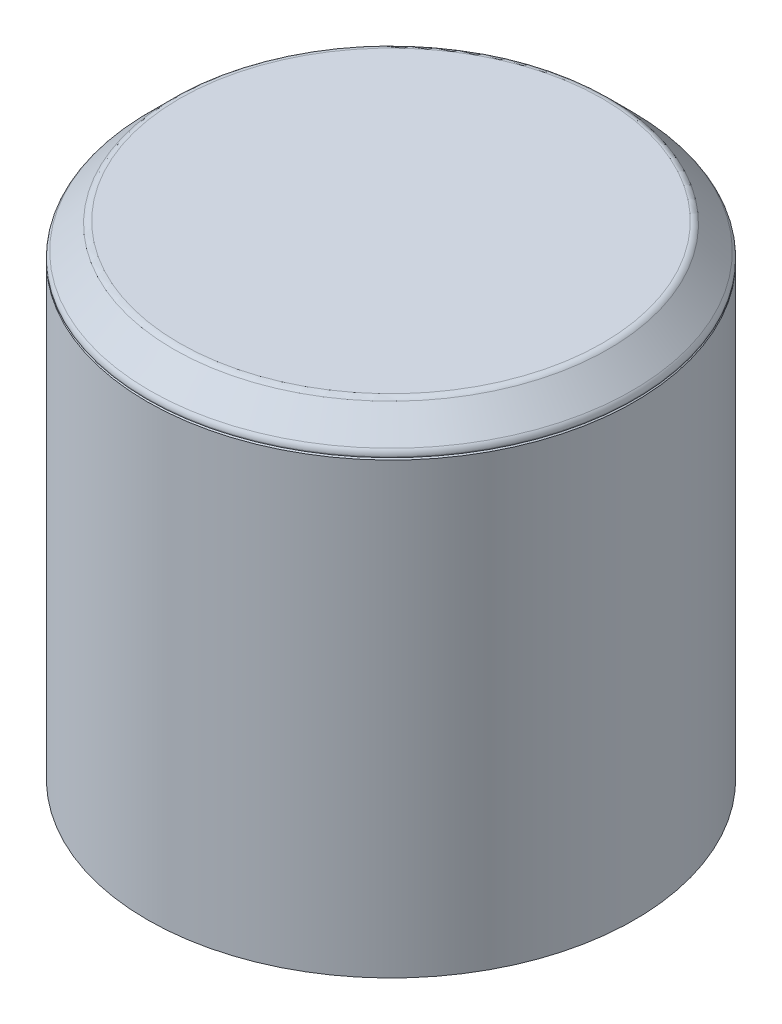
SolidWorks part; units mm, degrees
ref_plane "Ön Düzlem" through (0, 0, 0) normal (0, 0, 1) x (1, 0, 0)
ref_plane "Üst Düzlem" through (0, 0, 0) normal (0, 1, 0) x (1, 0, 0)
ref_plane "Sağ Düzlem" through (0, 0, 0) normal (1, 0, 0) x (0, 0, -1)
sketch "Çizim1" plane through (0, 0, 0) normal (1, 0, 0) x (0, 0, -1)
  line L1 (0, 0) -> (-59.5, 0)
  line L2 (0, 0) -> (0, 110)
  line L3 (0, 110) -> (-59.5, 110)
  line L4 (-59.5, 0) -> (-59.5, 110)
  line L5 (0, 0) -> (-45, 0)
  line L6 (0, 0) -> (0, -7)
  line L7 (0, -7) -> (-45, -7)
  line L8 (-45, 0) -> (-45, -7)
  dimension "D1" = 59.5
  dimension "D2" = 110
  dimension "D3" = 7
  dimension "D4" = 45
revolve "Döndür1" add sketch "Çizim1" angle 360 about L2
sketch "Çizim2" plane through (0, 110, 0) normal (0, 1, 0) x (1, 0, 0)
  circle A0 centre (0, 0) radius 59.5
extrude "Yükseklik-Ekstrüzyon1" add sketch "Çizim2" along normal blind 8 separate body
chamfer "Pah1" distance 0.5 angle 45 1 edges at (0, 110, -59.5)
chamfer "Pah2" distance 7 angle 45 1 edges at (0, 118, 59.5)
fillet "Radyus1" radius 2 2 edges at (0, 111, 59.5) (0, 118, 52.5)
